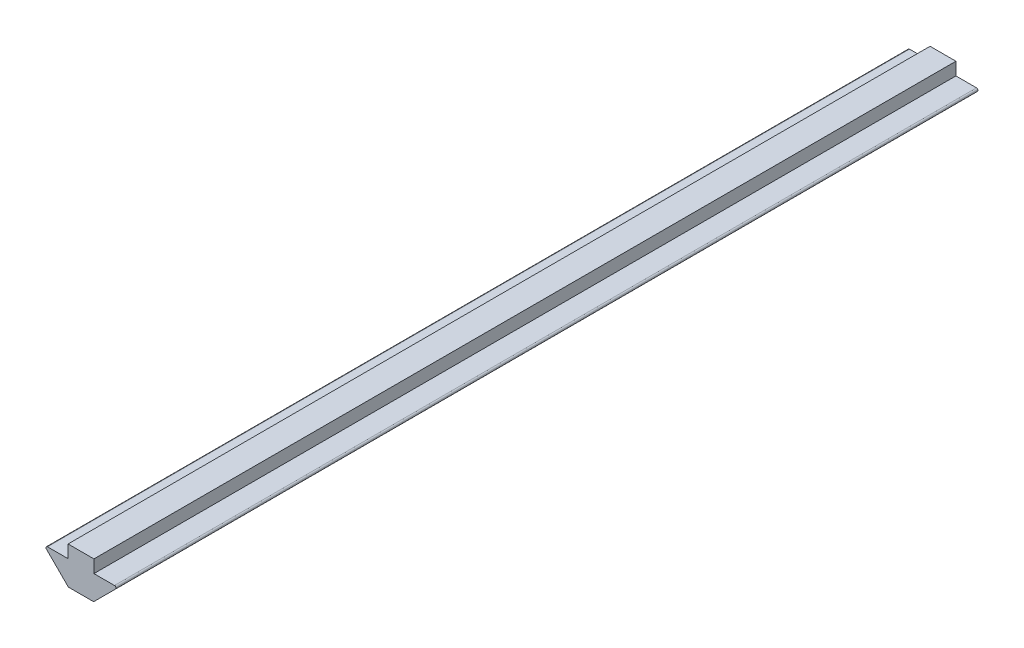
SolidWorks part; units mm, degrees
ref_plane "Front Plane" through (0, 0, 0) normal (0, 0, 1) x (1, 0, 0)
ref_plane "Top Plane" through (0, 0, 0) normal (0, 1, 0) x (1, 0, 0)
ref_plane "Right Plane" through (0, 0, 0) normal (1, 0, 0) x (0, 0, -1)
sketch "Sketch1" plane through (0, 0, 0) normal (0, 0, 1) x (1, 0, 0)
  line L0 (-6.6716, 8.9393) -> (-2.88, 8.9393) construction
  line L1 (6.6716, 8.9393) -> (2.88, 8.9393) construction
  line L2 (2.5993, 3.66) -> (7.0251, 8.0858) construction
  line L3 (2.5993, 3.66) -> (-2.5993, 3.66) construction
  line L4 (-2.5993, 3.66) -> (-7.0251, 8.0858) construction
  line L5 (-6.6716, 8.9393) -> (2.88, 8.9393)
  line L6 (6.6716, 8.9393) -> (2.88, 8.9393)
  line L7 (2.5993, 3.66) -> (7.0251, 8.0858)
  line L8 (2.5993, 3.66) -> (-2.5993, 3.66)
  line L9 (-2.5993, 3.66) -> (-7.0251, 8.0858) construction
  line L10 (2.5165, 3.86) -> (-2.5165, 3.86)
  line L11 (-2.5165, 3.86) -> (-6.8837, 8.2272)
  line L12 (-6.6716, 8.7393) -> (2.88, 8.7393)
  line L13 (6.6716, 8.7393) -> (2.88, 8.7393)
  line L14 (2.5165, 3.86) -> (6.8837, 8.2272)
  arc A0 (-6.6716, 8.9393) -> (-7.0251, 8.0858) centre (-6.6716, 8.4393) ccw construction
  arc A1 (7.0251, 8.0858) -> (6.6716, 8.9393) centre (6.6716, 8.4393) ccw construction
  arc A2 (-6.6716, 8.9393) -> (-7.0251, 8.0858) centre (-6.6716, 8.4393) ccw
  arc A3 (7.0251, 8.0858) -> (6.6716, 8.9393) centre (6.6716, 8.4393) ccw
  arc A4 (-6.6716, 8.7393) -> (-6.8837, 8.2272) centre (-6.6716, 8.4393) ccw
  arc A5 (6.8837, 8.2272) -> (6.6716, 8.7393) centre (6.6716, 8.4393) ccw
  dimension "D1" = 0.2
extrude "Boss-Extrude1" add sketch "Sketch1" against normal blind 171.7 contours L14 A5 L13 L12 A4 L11 L10
ref_plane "Plane2" through (0, 0, -159) normal (0, 0, -1) x (-1, 0, 0)
sketch "Sketch4" plane through (0, 8.7393, 0) normal (0, 1, 0) x (1, 0, 0)
  line L0 (0, 171.7) -> (0, 0) construction
  line L2 (-2.575, 0) -> (2.575, 0)
  line L3 (-2.575, 0) -> (-2.575, 171.7)
  line L4 (-6.6716, 0) -> (6.6716, 0)
  line L5 (6.6716, 0) -> (6.6716, 171.7)
  line L6 (6.6716, 171.7) -> (-6.6716, 171.7)
  line L7 (-6.6716, 171.7) -> (-6.6716, 0)
  line L8 (-6.6716, 0) -> (6.6716, 0) construction
  line L9 (6.6716, 0) -> (6.6716, 171.7) construction
  line L10 (6.6716, 171.7) -> (-6.6716, 171.7) construction
  line L11 (-6.6716, 171.7) -> (-6.6716, 0) construction
  line L12 (-2.575, 171.7) -> (2.575, 171.7)
  line L13 (2.575, 0) -> (2.575, 171.7)
  line L14 (-2.575, 0) -> (2.575, 171.7) construction
  line L15 (-2.575, 171.7) -> (2.575, 0) construction
  line L18 (-2.575, 85.85) -> (2.575, 85.85) construction
  point P6 (0, 85.85)
  dimension "D2" = 5.15
  dimension "D1" = 0
extrude "Boss-Extrude2" add sketch "Sketch4" along normal blind 2.54
